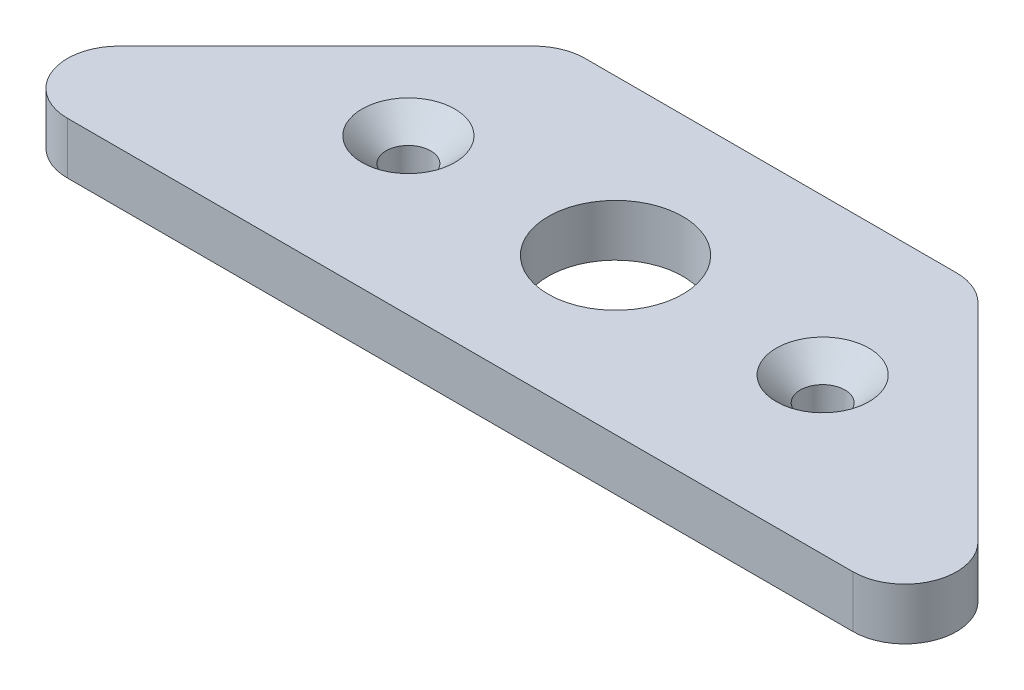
SolidWorks part; units mm, degrees
ref_plane "Front Plane" through (0, 0, 0) normal (0, 0, 1) x (1, 0, 0)
ref_plane "Top Plane" through (0, 0, 0) normal (0, 1, 0) x (1, 0, 0)
ref_plane "Right Plane" through (0, 0, 0) normal (1, 0, 0) x (0, 0, -1)
sketch "Sketch1" plane through (0, 0, 0) normal (0, 1, 0) x (1, 0, 0)
  line L0 (-10, 0) -> (-10, -15) construction
  line L1 (-10, -15) -> (-50, -15)
  line L2 (-50, -15) -> (-20, 15)
  line L3 (-20, 15) -> (20, 15)
  line L4 (0, -879.853) -> (0, 43112.799) construction
  line L5 (50, -15) -> (20, 15)
  line L6 (10, -15) -> (50, -15)
  line L7 (10, 0) -> (10, -15) construction
  line L8 (-10, -15) -> (10, -15)
  arc A0 (10, 0) -> (-10, 0) centre (0, 0) ccw construction
  circle A3 centre (0, 0) radius 6.5
  point P11 (0, 15)
  dimension "D1" = 10
  dimension "D7" = 13
  dimension "D2" = 15
  dimension "D3" = 40
  dimension "D4" = 90
  dimension "D5" = 30
extrude "Boss-Extrude1" add sketch "Sketch1" along normal blind 5
fillet "Fillet1" radius 5 4 edges at (-20, 2.5, -15) (20, 2.5, -15) (-50, 2.5, 15) (50, 2.5, 15)
hole_wizard "CSK for M4 SFHCS1" positions "Sketch10" profile "Sketch11" countersink size "M4" standard "ANSI Metric"
sketch "Sketch10" plane through (0, 5, 0) normal (0, 1, 0) x (1, 0, 0)
  point P0 (-20, 0)
  point P2 (20, 0)
  dimension "D1" = 40
  dimension "D2" = 20
sketch "Sketch11" plane through (-20, 5, 0) normal (1, 0, 0) x (0, 0, 1)
  line L0 (0, 0) -> (0, 12.7919)
  line L1 (0, 12.7919) -> (2.15, 11.5)
  line L2 (2.15, 11.5) -> (2.15, 2.33)
  line L3 (2.15, 2.33) -> (4.48, 0)
  line L5 (4.48, 0) -> (0, 0)
  line L6 (-2.15, 2.33) -> (-4.48, 0) construction
  line L10 (0, 12.7919) -> (-2.15, 11.5) construction
  line L11 (0, -6.35) -> (0, 107.95) construction
  dimension "Hole Dia." = 4.3
  dimension "Hole Depth" = 11.5
  dimension "Near C'Sink Dia." = 8.96
  dimension "Near C'Sink Angle" = 90
  dimension "Drill Angle" = 118
